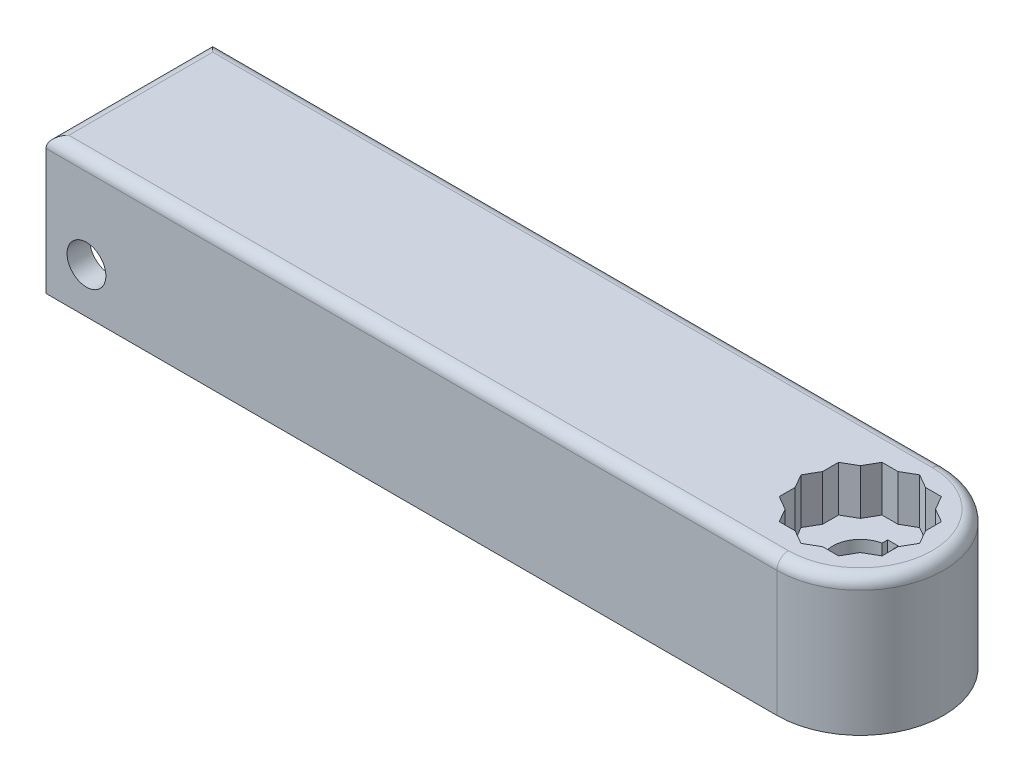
SolidWorks part; units mm, degrees
ref_plane "Front Plane" through (0, 0, 0) normal (0, 0, 1) x (1, 0, 0)
ref_plane "Top Plane" through (0, 0, 0) normal (0, 1, 0) x (1, 0, 0)
ref_plane "Right Plane" through (0, 0, 0) normal (1, 0, 0) x (0, 0, -1)
sketch "Sketch1"
  dimension "D1" = 92.71
  dimension "D2" = 406.4
extrude "Extrude1" add sketch "Sketch1" along normal blind 76.2
sketch "Sketch2"
  dimension "D1" = 12.7
extrude "Extrude2" cut sketch "Sketch2" against normal blind 6.35
sketch "Sketch3"
extrude "Extrude3" cut sketch "Sketch3" against normal blind 25.4
sketch "Sketch4"
extrude "Extrude4" cut sketch "Sketch4" against normal through all
fillet "Fillet1" radius 6.35 4 edges at (203.2, 76.2, -92.71) (452.755, 76.2, -46.355) (0, 76.2, -46.355) (203.2, 76.2, 0)
sketch "Sketch6"
  dimension "D1" = 57.15
extrude "HexCut1" cut sketch "Sketch6" against normal blind 25.4
sketch "Sketch7"
extrude "HexCut2" cut sketch "Sketch7" against normal blind 25.4
sketch "Sketch8"
  dimension "D3" = 15.3336
  dimension "D1" = 5.9634
  dimension "D2" = 3.175
extrude "Keyway" cut sketch "Sketch8" against normal blind 38.1
sketch "Sketch9"
extrude "Hole" cut sketch "Sketch9" against normal through all
